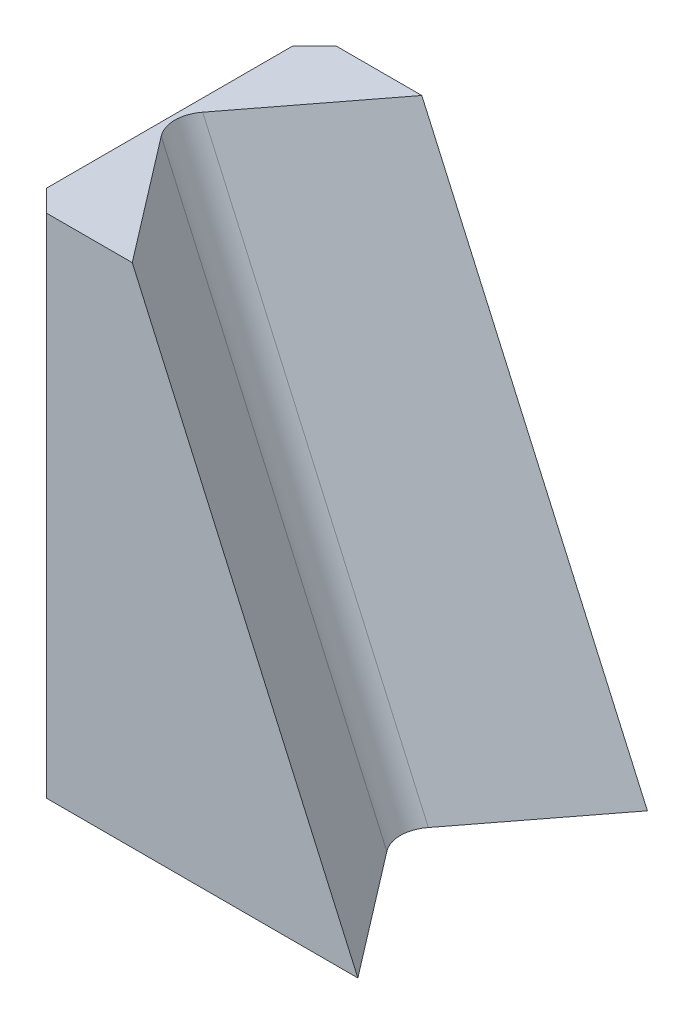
SolidWorks part; units mm, degrees
ref_plane "前视基准面" through (0, 0, 0) normal (0, 0, 1) x (1, 0, 0)
ref_plane "上视基准面" through (0, 0, 0) normal (0, 1, 0) x (1, 0, 0)
ref_plane "右视基准面" through (0, 0, 0) normal (1, 0, 0) x (0, 0, -1)
other "Configuration Table"
sketch "草图1" plane through (0, 0, 0) normal (0, 0, 1) x (1, 0, 0)
  line L0 (0, 7) -> (0, 0)
  line L1 (0, 0) -> (4.6, 0)
  line L2 (4.6, 0) -> (1.4834, 7)
  line L3 (1.4834, 7) -> (0, 7)
  dimension "D1" = 7
  dimension "D2" = 4.6
  dimension "D3" = 66
extrude "凸台-拉伸1" add sketch "草图1" along normal blind 4
ref_plane "基准面1" through (-2.3556, 5.2908, 0) normal (0.4067, -0.9135, 0) x (0, 0, -1)
sketch "草图2" plane through (-2.3556, 5.2908, 0) normal (0.4067, -0.9135, 0) x (0, 0, -1)
  line L0 (-2, 4.2023) -> (-2, 1.4621) construction
  line L1 (-4, 4.2023) -> (0, 4.2023) construction
  line L2 (-4, 4.2023) -> (-2.2868, 3.0027)
  line L3 (0, 4.2023) -> (-1.7132, 3.0027)
  line L4 (0, 4.2023) -> (0, 2.8472) construction
  line L5 (-4, 4.2023) -> (0, 4.2023)
  arc A0 (-2.2868, 3.0027) -> (-1.7132, 3.0027) centre (-2, 3.4123) ccw
  dimension "D2" = 1
  dimension "D1" = 55
extrude "切除-拉伸1" cut sketch "草图2" against normal up to next and the other way up to next
chamfer "倒角1" distance 0.3 angle 45 2 edges at (0, 3.5, 0) (0, 3.5, 4)
ref_plane "基准面2" through (0, 0, 2) normal (0, 0, 1) x (1, 0, 0)
